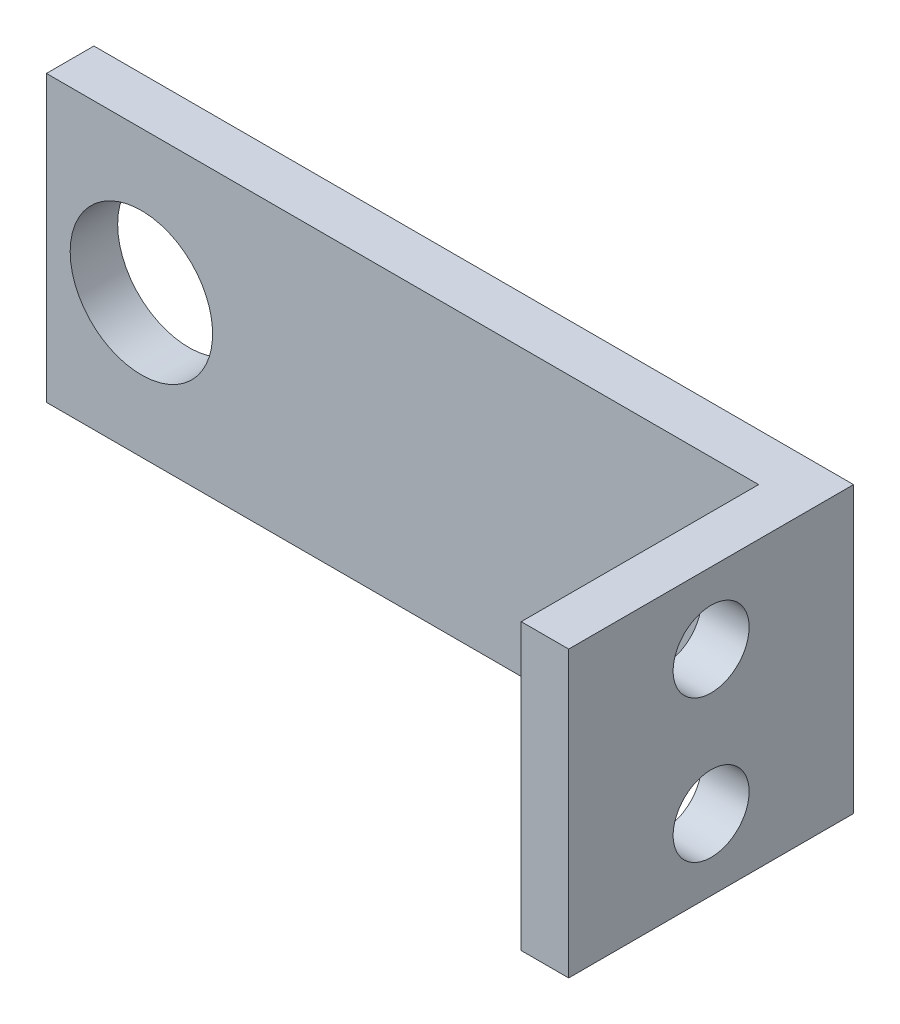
SolidWorks part; units mm, degrees
ref_plane "Plan1" through (0, 0, 0) normal (0, 0, 1) x (1, 0, 0)
ref_plane "Plan2" through (0, 0, 0) normal (0, 1, 0) x (1, 0, 0)
ref_plane "Plan3" through (0, 0, 0) normal (1, 0, 0) x (0, 0, -1)
sketch "Esquisse1" plane through (0, 0, 0) normal (0, 0, 1) x (1, 0, 0)
  line L1 (0, 0) -> (80, 0)
  line L2 (0, 0) -> (0, 30)
  line L3 (0, 30) -> (80, 30)
  line L4 (80, 0) -> (80, 30)
  dimension "D1" = 30
  dimension "D2" = 80
extrude "Base-Extrusion" add sketch "Esquisse1" along normal blind 5
sketch "Esquisse2" plane through (0, 0, 5) normal (0, 0, 1) x (1, 0, 0)
  line L0 (0, 0) -> (80, 0) construction
  line L1 (80, 30) -> (75, 30)
  line L2 (80, 30) -> (80, 0)
  line L3 (80, 0) -> (75, 0)
  line L4 (75, 30) -> (75, 0)
  dimension "D1" = 5
extrude "Boss.-Extru.1" add sketch "Esquisse2" along normal blind 25
sketch "Esquisse3" plane through (0, 0, 0) normal (0, 0, -1) x (-1, 0, 0)
  line L0 (-80, 0) -> (-80, 30) construction
  line L1 (0, 0) -> (-80, 0) construction
  circle A0 centre (-10, 15) radius 7.5
  dimension "D3" = 15
  dimension "D1" = 70
  dimension "D2" = 15
extrude "Enlèv. mat.-Extru.1" cut sketch "Esquisse3" against normal through all
sketch "Esquisse4" plane through (80, 0, 0) normal (1, 0, 0) x (0, 0, -1)
  line L0 (-15, 34) -> (-15, -7) construction
  line L1 (-30, 0) -> (-30, 30) construction
  line L2 (-30, 0) -> (0, 0) construction
  circle A0 centre (-15, 22.5) radius 4
  circle A1 centre (-15, 7.5) radius 4
  dimension "D2" = 8
  dimension "D3" = 8
  dimension "D1" = 15
  dimension "D4" = 15
  dimension "D5" = 7.5
extrude "Enlèv. mat.-Extru.2" cut sketch "Esquisse4" against normal through all
